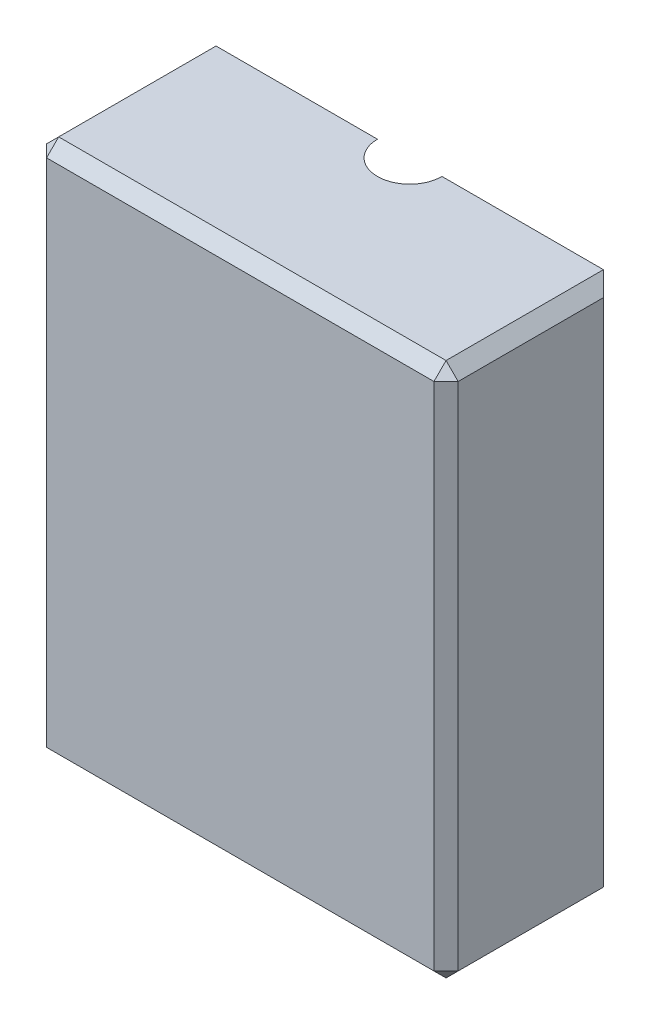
SolidWorks part; units mm, degrees
ref_plane "Plan de face" through (0, 0, 0) normal (0, 0, 1) x (1, 0, 0)
ref_plane "Plan de dessus" through (0, 0, 0) normal (0, 1, 0) x (1, 0, 0)
ref_plane "Plan de droite" through (0, 0, 0) normal (1, 0, 0) x (0, 0, -1)
sketch "Esquisse1" plane through (0, 0, 0) normal (0, 0, 1) x (1, 0, 0)
  line L0 (13.3401, 92.9352) -> (-13.3401, 92.9352) construction
  line L1 (85, -127.9352) -> (-85, -127.9352)
  line L2 (85, -127.9352) -> (85, 92.9352)
  line L3 (85, 92.9352) -> (-85, 92.9352)
  line L4 (-85, -127.9352) -> (-85, 92.9352)
  line L5 (-23.9656, -127.9352) -> (23.9656, -127.9352) construction
  dimension "D1" = 85
  dimension "D2" = 85
extrude "Extrusion1" add sketch "Esquisse1" along normal blind 70
sketch "Esquisse2" plane through (0, 0, 0) normal (0, 0, 1) x (1, 0, 0)
  circle A1 centre (-51.9185, -61.9637) radius 3
  circle A2 centre (-51.9185, 48.916) radius 3
  circle A3 centre (55.1779, -17.1462) radius 3
  dimension "D1" = 6
  dimension "D2" = 6
  dimension "D3" = 6
extrude "Extrusion2" add sketch "Esquisse2" against normal blind 5 draft 10
other "Empreinte1"
other "noyau_intérieur<3>@moyeu de roue"
chamfer "Chanfrein1" distance 5 angle 45 10 edges at (0, -127.9352, 70) (-85, -17.5, 70) (85, -17.5, 70) (85, -127.9352, 35) (85, -17.5, 0) (85, 92.9352, 35) (0, 92.9352, 70) (-85, -127.9352, 35) (-85, -17.5, 0) (-85, 92.9352, 35)
